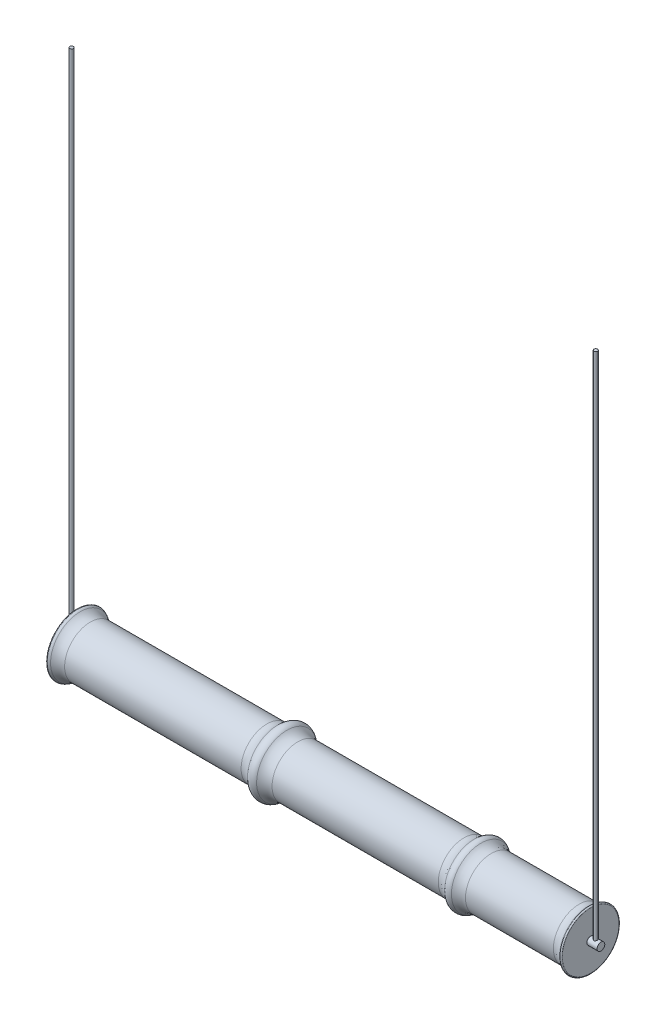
SolidWorks part; units mm, degrees
ref_plane "Alzado" through (0, 0, 0) normal (0, 0, 1) x (1, 0, 0)
ref_plane "Planta" through (0, 0, 0) normal (0, 1, 0) x (1, 0, 0)
ref_plane "Vista lateral" through (0, 0, 0) normal (1, 0, 0) x (0, 0, -1)
sketch "Croquis2" plane through (0, 0, 0) normal (0, 0, 1) x (1, 0, 0)
  line L0 (-500, 0) -> (500, 0)
  line L1 (-500, 50) -> (500, 50) construction
  line L2 (-500, 60) -> (-500, 0)
  line L3 (-490, 50) -> (-112.5, 50)
  line L4 (-87.5, 50) -> (270, 50)
  line L5 (290, 50) -> (492.5, 50)
  line L6 (500, 57.5) -> (500, 0)
  arc A0 (-490, 50) -> (-500, 60) centre (-500, 50) ccw
  arc A1 (-87.5, 50) -> (-112.5, 50) centre (-100, 50) ccw
  arc A2 (290, 50) -> (270, 50) centre (280, 50) ccw
  arc A3 (500, 57.5) -> (492.5, 50) centre (500, 50) ccw
  point P4 (0, 0)
  dimension "D5" = 15
  dimension "D6" = 20
  dimension "D7" = 25
  dimension "D8" = 20
  dimension "D1" = 1000
  dimension "D2" = 50
  dimension "D3" = 380
  dimension "D4" = 400
revolve "Revolución1" add sketch "Croquis2" angle 360 about L0
fillet "Redondeo1" radius 30 6 edges at (-112.5, -50, 0) (-490, -50, 0) (492.5, -50, 0) (290, -50, 0) (270, -50, 0) (-87.5, -50, 0)
fillet "Redondeo4" radius 2 2 edges at (500, -57.5, 0) (-500, -60, 0)
sketch "Croquis3" plane through (500, 0, 0) normal (1, 0, 0) x (0, 0, -1)
  circle A0 centre (0, 0) radius 7.5
  dimension "D1" = 15
extrude "Saliente-Extruir1" add sketch "Croquis3" along normal blind 20 separate body
sketch "Croquis4" plane through (0, 0, 0) normal (0, 1, 0) x (1, 0, 0)
  line L0 (520, -7.5) -> (520, 7.5) construction
  circle A0 centre (510, 0) radius 3.5
  dimension "D2" = 7
  dimension "D1" = 10
extrude "Saliente-Extruir2" add sketch "Croquis4" along normal blind 1000
mirror "Simetría1" about plane through (0, 0, 0) normal (1, 0, 0)
